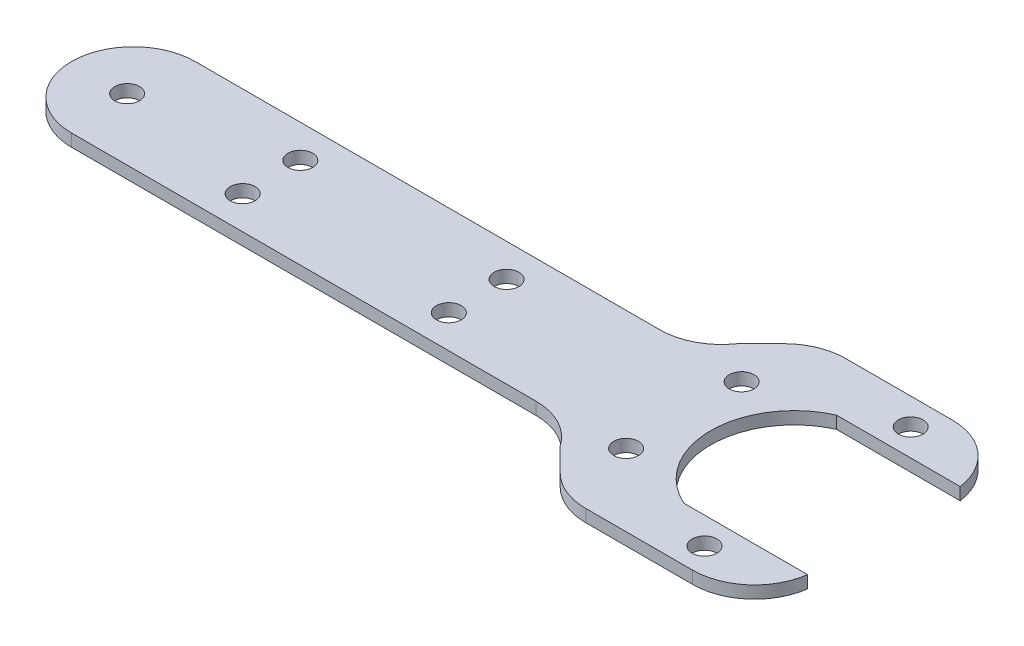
SolidWorks part; units mm, degrees
ref_plane "Front Plane" through (0, 0, 0) normal (0, 0, 1) x (1, 0, 0)
ref_plane "Top Plane" through (0, 0, 0) normal (0, 1, 0) x (1, 0, 0)
ref_plane "Right Plane" through (0, 0, 0) normal (1, 0, 0) x (0, 0, -1)
sketch "Sketch2" plane through (0, 0, 0) normal (0, 1, 0) x (1, 0, 0)
  line L1 (-98.5, 31.5) -> (98.5, 31.5)
  line L2 (-98.5, 31.5) -> (-98.5, -31.5)
  line L3 (-98.5, -31.5) -> (98.5, -31.5)
  line L4 (98.5, 31.5) -> (98.5, -31.5)
  line L5 (-98.5, 31.5) -> (98.5, -31.5) construction
  line L6 (-98.5, -31.5) -> (98.5, 31.5) construction
  point P0 (0, 0)
  dimension "D1" = 63
  dimension "D2" = 197
extrude "Boss-Extrude1" add sketch "Sketch2" along normal blind 3 contours L2 L3 L4 L1
sketch "Sketch3" plane through (0, 3, 0) normal (0, 1, 0) x (1, 0, 0)
  line L0 (-98.5, 0) -> (98.5, 0) construction
  line L1 (-98.5, 31.5) -> (-98.5, -31.5) construction
  line L2 (98.5, 31.5) -> (98.5, -31.5) construction
  line L3 (41.5, 31.5) -> (41.5, -31.5) construction
  line L4 (98.5, 18.5) -> (68.5, 18.5)
  line L5 (98.5, 18.5) -> (98.5, -18.5)
  line L6 (98.5, -18.5) -> (68.5, -18.5)
  line L7 (68.5, 18.5) -> (68.5, -18.5)
  line L8 (98.5, 18.5) -> (68.5, -18.5) construction
  line L9 (98.5, -18.5) -> (68.5, 18.5) construction
  line L10 (-98.5, 31.5) -> (98.5, 31.5) construction
  line L11 (-98.5, -31.5) -> (98.5, -31.5) construction
  line L13 (-98.5, 31.5) -> (41.5, 31.5)
  line L14 (-98.5, 31.5) -> (-98.5, 15)
  line L15 (-98.5, 15) -> (41.5, 15)
  line L16 (41.5, 31.5) -> (41.5, 15)
  line L17 (-98.5, -31.5) -> (41.5, -31.5)
  line L18 (-98.5, -31.5) -> (-98.5, -15)
  line L19 (-98.5, -15) -> (41.5, -15)
  line L20 (41.5, -31.5) -> (41.5, -15)
  arc A0 (68.5, 18.5) -> (68.5, -18.5) centre (76.7604, 0) ccw
  spline S0 degree 1 poles (68.5, 18.5) (68.5, -18.5) knots 0 0 1 1
  point P6 (83.5, 0)
  point P26 (56.5, 0)
  dimension "D1" = 37
  dimension "D2" = 30
  dimension "D3" = 140
  dimension "D4" = 30
  dimension "D5" = 12
extrude "Cut-Extrude1" cut sketch "Sketch3" against normal up to next
fillet "Fillet1" radius 15 2 edges at (-98.5, 1.5, -15) (-98.5, 1.5, 15)
fillet "Fillet3" radius 15 2 edges at (98.5, 1.5, 31.5) (98.5, 1.5, -31.5)
chamfer "Chamfer2" distance 10 angle 45 2 edges at (41.5, 1.5, 31.5) (41.5, 1.5, -31.5)
fillet "Fillet4" radius 15 2 edges at (41.5, 1.5, -15) (41.5, 1.5, 15)
fillet "Fillet5" radius 15 2 edges at (51.5, 1.5, -31.5) (51.5, 1.5, 31.5)
sketch "Sketch4" plane through (0, 3, 0) normal (0, 1, 0) x (1, 0, 0)
  line L0 (-98.5, 0) -> (98.5, 0) construction
  line L1 (98.5, 18.5) -> (98.5, -18.5) construction
  line L2 (0, -76.2982) -> (0, 76.2982) construction
  circle A0 centre (-85, 0) radius 3
  circle A1 centre (80, 25) radius 3
  circle A2 centre (50, 14) radius 3
  circle A7 centre (-50, 7) radius 3
  circle A8 centre (0, 7) radius 3
  circle A10 centre (80, -25) radius 3
  circle A11 centre (50, -14) radius 3
  circle A12 centre (0, -7) radius 3
  circle A13 centre (-50, -7) radius 3
  point P11 (0, 0)
  point P29 (82.8133, 25.1358)
  dimension "D1" = 6
  dimension "D4" = 50
  dimension "D2" = 25
  dimension "D3" = 80
  dimension "D5" = 14
  dimension "D7" = 7
  dimension "D8" = 7
  dimension "D9" = 50
  dimension "D10" = 85
extrude "Cut-Extrude2" cut sketch "Sketch4" against normal blind 3
